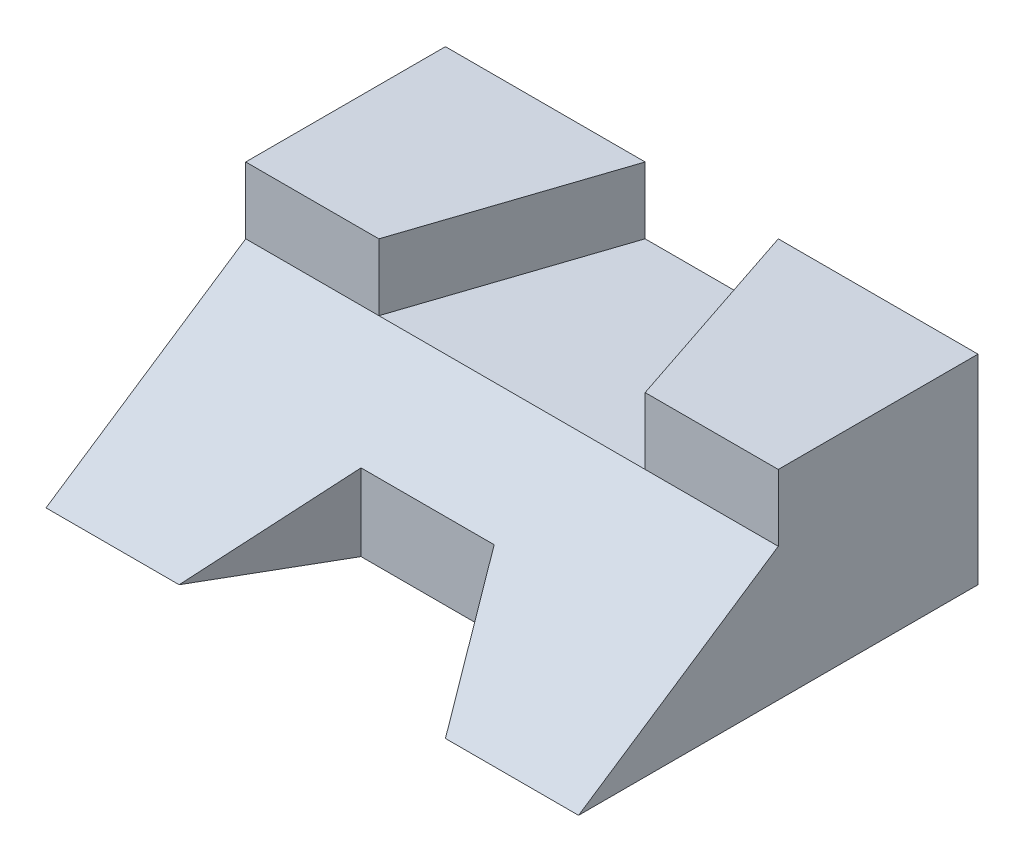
SolidWorks part; units mm, degrees
ref_plane "Front Plane" through (0, 0, 0) normal (0, 0, 1) x (1, 0, 0)
ref_plane "Top Plane" through (0, 0, 0) normal (0, 1, 0) x (1, 0, 0)
ref_plane "Right Plane" through (0, 0, 0) normal (1, 0, 0) x (0, 0, -1)
sketch "Sketch1" plane through (0, 0, 0) normal (1, 0, 0) x (0, 0, -1)
  line L0 (0, 0) -> (152.4, 0)
  line L1 (152.4, 0) -> (152.4, 76.2)
  line L2 (152.4, 76.2) -> (76.2, 76.2)
  line L3 (0, 0) -> (76.2, 50.8)
  line L5 (76.2, 50.8) -> (76.2, 76.2)
  dimension "D1" = 152.4
  dimension "D2" = 76.2
  dimension "D3" = 76.2
  dimension "D4" = 25.4
extrude "Extrude1" add sketch "Sketch1" along normal mid plane 203.2
sketch "Sketch2" plane through (0, 76.2, 0) normal (0, 1, 0) x (-1, 0, 0)
  line L0 (0, -152.4) -> (0, -76.2) construction
  line L1 (-101.6, -152.4) -> (101.6, -152.4) construction
  line L2 (-101.6, -76.2) -> (101.6, -76.2) construction
  line L3 (50.8, -76.2) -> (-50.8, -76.2)
  line L4 (-50.8, -76.2) -> (-25.4, -152.4)
  line L5 (50.8, -76.2) -> (25.4, -152.4)
  line L6 (-25.4, -152.4) -> (25.4, -152.4)
  dimension "D1" = 50.8
  dimension "D2" = 101.6
extrude "Cut-Extrude1" cut sketch "Sketch2" against normal up to vertex (25.4 mm away)
sketch "Sketch3" plane through (0, 0, 0) normal (0, -1, 0) x (1, 0, 0)
  line L0 (0, 0) -> (0, -43.9941) construction
  line L1 (-50.8, 0) -> (50.8, 0)
  line L2 (101.6, 0) -> (-101.6, 0) construction
  line L3 (50.8, 0) -> (25.4, -43.9941)
  line L4 (-50.8, 0) -> (-25.4, -43.9941)
  line L5 (25.4, -43.9941) -> (-25.4, -43.9941)
  dimension "D1" = 101.6
  dimension "D2" = 50.8
  dimension "D3" = 50.8
extrude "Cut-Extrude2" cut sketch "Sketch3" against normal through all
